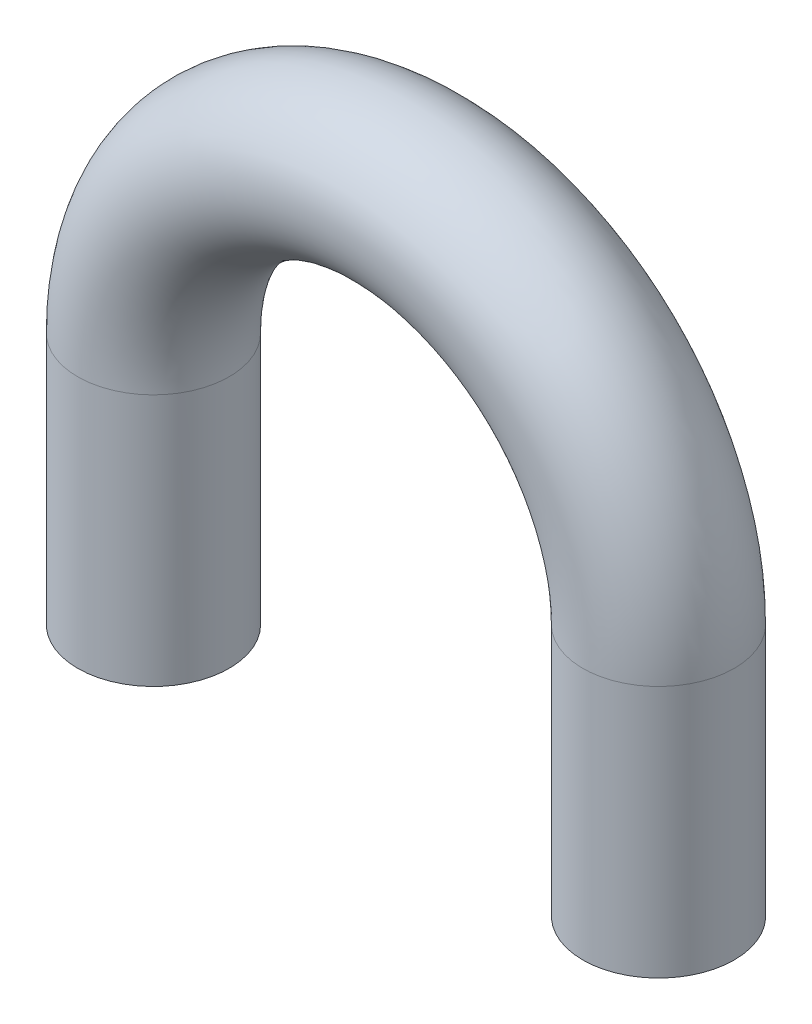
SolidWorks part; units mm, degrees
ref_plane "Face" through (0, 0, 0) normal (0, 0, 1) x (1, 0, 0)
ref_plane "Dessus" through (0, 0, 0) normal (0, 1, 0) x (1, 0, 0)
ref_plane "Droite" through (0, 0, 0) normal (1, 0, 0) x (0, 0, -1)
sketch "Esquisse1" plane through (0, 0, 0) normal (0, 0, 1) x (1, 0, 0)
  line L0 (0, 0) -> (0, 5)
  line L1 (10, 5) -> (10, 0)
  arc A0 (0, 5) -> (10, 5) centre (5, 5) cw
  dimension "D1" = 5
  dimension "D2" = 5
sketch "Esquisse2" plane through (0, 0, 0) normal (0, 1, 0) x (1, 0, 0)
  circle A0 centre (0, 0) radius 1.5
  dimension "D1" = 3
sweep "Balayage1" add profiles "Esquisse2" path "Esquisse1"
